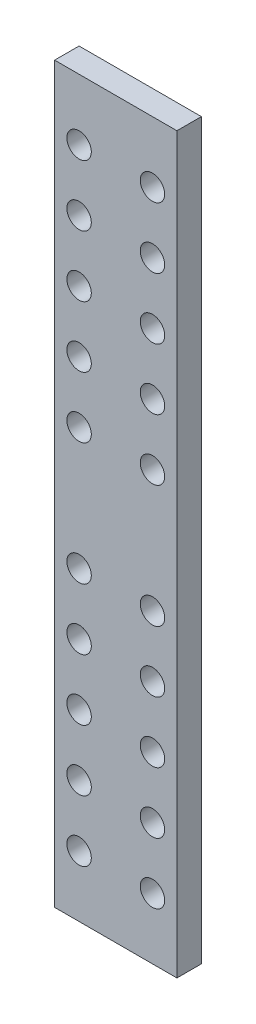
SolidWorks part; units mm, degrees
other "Connection Feature" parameters "D1"=24.8406, "D2"=222.9167, "D3"=18.7351, "D4"=20.9513, "D5"=20.5149, "D6"=17.53, "4"=25.4, "D7"=33.02, "D8"=8.9803, "D9"=17.9605, "Thru Hole Dia."=10, "Thru Hole Depth"=10
ref_plane "Front Plane" through (0, 0, 0) normal (0, 0, 1) x (1, 0, 0)
ref_plane "Top Plane" through (0, 0, 0) normal (0, 1, 0) x (1, 0, 0)
ref_plane "Right Plane" through (0, 0, 0) normal (1, 0, 0) x (0, 0, -1)
sketch "Sketch1" plane through (0, 0, 0) normal (0, 0, 1) x (1, 0, 0)
  line L1 (25, 150) -> (-25, 150)
  line L2 (25, 150) -> (25, -150)
  line L3 (25, -150) -> (-25, -150)
  line L4 (-25, 150) -> (-25, -150)
  line L5 (0, -150) -> (0, 150) construction
  line L6 (25, 0) -> (-25, 0) construction
  point P0 (0, 0)
extrude "Boss-Extrude1" add sketch "Sketch1" along normal blind 10
hole_wizard "Ø10.0mm Dowel Hole1" positions "Sketch2" profile "Sketch3" hole size "Ø10.0" standard "ISO"
sketch "Sketch2" plane through (0, 0, 10) normal (0, 0, 1) x (1, 0, 0)
  line L0 (-15, 125) -> (-15, 25) construction
  line L2 (-25, 150) -> (-25, -150) construction
  line L3 (25, 150) -> (-25, 150) construction
  point P0 (-15, 125)
  point P2 (-15, 100)
  point P4 (-15, 75)
  point P6 (-15, 50)
  point P8 (-15, 25)
sketch "Sketch3" plane through (-15, 125, 10) normal (1, 0, 0) x (0, -1, 0)
  line L0 (0, 0) -> (0, 10)
  line L1 (0, 10) -> (5, 10)
  line L2 (5, 10) -> (5, 0)
  line L5 (5, 0) -> (0, 0)
  line L11 (0, -6.35) -> (0, 107.95) construction
mirror "Mirror1" about plane through (0, 0, 0) normal (1, 0, 0) of "Ø10.0mm Dowel Hole1"
mirror "Mirror2" about plane through (0, 0, 0) normal (0, 1, 0) of "Mirror1", "Ø10.0mm Dowel Hole1"
